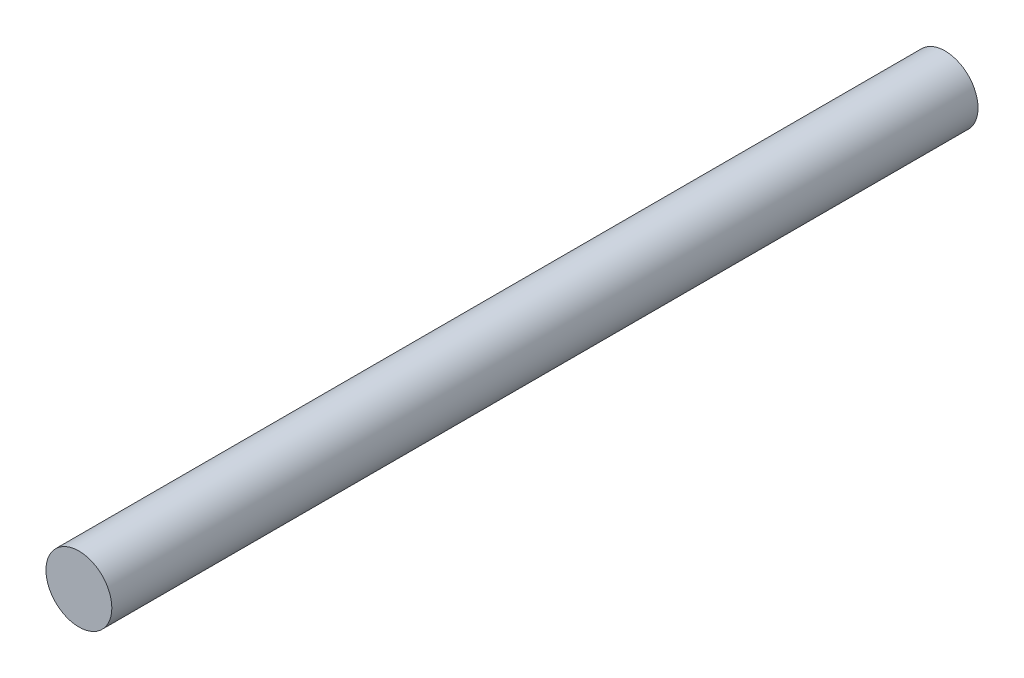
SolidWorks part; units mm, degrees
ref_plane "Plan de face" through (0, 0, 0) normal (0, 0, 1) x (1, 0, 0)
ref_plane "Plan de dessus" through (0, 0, 0) normal (0, 1, 0) x (1, 0, 0)
ref_plane "Plan de droite" through (0, 0, 0) normal (1, 0, 0) x (0, 0, -1)
sketch "Esquisse1" plane through (0, 0, 0) normal (0, 0, 1) x (1, 0, 0)
  circle A0 centre (0, 0) radius 35
  dimension "D1" = 70
extrude "Extrusion1" add sketch "Esquisse1" along normal mid plane 920
